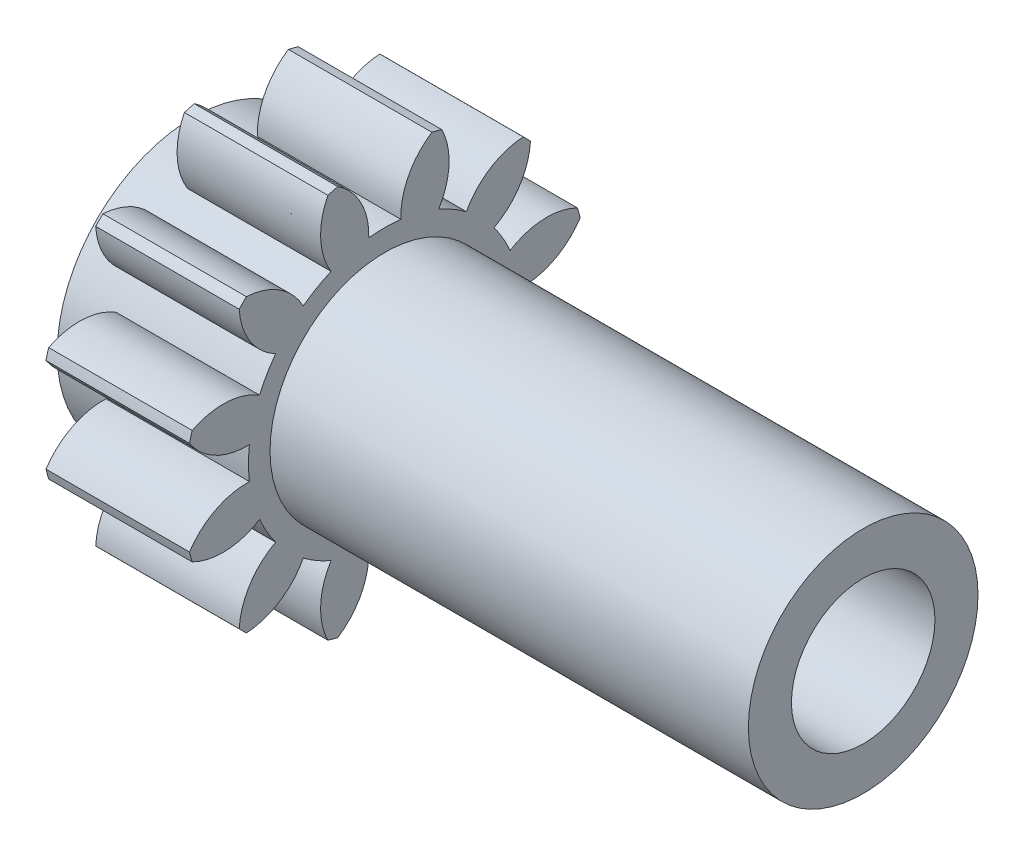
SolidWorks part; units mm, degrees
ref_plane "Plane1" through (0, 0, 0) normal (0, 0, 1) x (1, 0, 0)
ref_plane "Plane2" through (0, 0, 0) normal (0, 1, 0) x (1, 0, 0)
ref_plane "Plane3" through (0, 0, 0) normal (1, 0, 0) x (0, 0, -1)
other "Configuration Table"
sketch "HoldingSke" plane through (0, 0, 0) normal (0, 1, 0) x (1, 0, 0)
  line L0 (0, 0) -> (0.326, -0.0693)
  line L1 (-15, 0) -> (100, 0) construction
  line L2 (0, 0) -> (-2.1039, 2.3779)
  line L3 (0, 0) -> (-11.863, 4.5341)
  line L4 (0, 0) -> (8.4473, 1.7955)
  line L5 (0, 0) -> (-46.8476, -17.4728)
  line L6 (0, 0) -> (-12.4344, -8.3896)
  line L7 (-2.1039, 2.3779) -> (8.6586, 51.2059)
  line L8 (-76.2, 54.61) -> (-73.9, 54.61)
  line L9 (-71.009, 38.7566) -> (-53.1078, 45.2721)
  line L10 (-76.2, 71.12) -> (104.1128, 71.12)
  line L11 (0, 0) -> (-15, 0)
  line L12 (-76.2, 101.6) -> (-76.093, 101.6)
  line L13 (24.9733, 27.94) -> (52.9518, 28.4284)
  line L14 (24.9733, 27.94) -> (24.9743, 27.94)
  line L15 (24.9733, 27.94) -> (100.4006, 29.5858)
  line L16 (-63.627, -3) -> (-12.827, -3)
  circle A0 centre (0, 0) radius 7.5
  circle A1 centre (0, 0) radius 14.249
  circle A2 centre (0, 0) radius 37.5
  circle A3 centre (0, 0) radius 7.5
sketch "BasProSke" plane through (0, 0, 0) normal (0, 1, 0) x (1, 0, 0)
  line L0 (-10, 0) -> (60, 0) construction
  line L1 (0, 0) -> (0, 21)
  line L2 (0, 0) -> (15, 0)
  line L3 (15, 0) -> (15, 21)
  line L4 (15, 21) -> (0, 21)
revolve "Base-Revolve" add sketch "BasProSke" angle 360 about L0
sketch "TooCutSke" plane through (0, 0, 0) normal (1, 0, 0) x (0, 0, -1)
  line L1 (0, 0) -> (0, 107) construction
  line L2 (0, 0) -> (-2.5365, 17.8204) construction
  line L3 (0, 0) -> (-9.25, 34.5215) construction
  line L4 (-2.5365, 17.8204) -> (-4.625, 17.2608) construction
  arc A0 (1.6769, 14.15) -> (-1.6769, 14.15) centre (0, 0) ccw
  arc A1 (4.9456, 20.4355) -> (-4.9456, 20.4355) centre (0, 0) ccw
  circle A2 centre (0, 0) radius 18 construction
  circle A3 centre (0, 0) radius 16.9145 construction
  arc A4 (-1.6769, 14.15) -> (-4.9456, 20.4355) centre (-8.8725, 14.4006) ccw
  arc A5 (4.9456, 20.4355) -> (1.6769, 14.15) centre (8.8725, 14.4006) ccw
extrude "ToothCut" cut sketch "TooCutSke" along normal through all
fillet "Breaks" [suppressed] radius 0.06
fillet "RootFillets" [suppressed] radius 0.751
pattern_circular "TeethCuts" count 12 every 30 about axis through (-10, 0, 0) along (1, 0, 0) of "ToothCut"
sketch "HubNeaOneSke" plane through (0, 0, 0) normal (-1, 0, 0) x (0, 0, 1)
  circle A0 centre (0, 0) radius 14.249
extrude "HubNearOne" add sketch "HubNeaOneSke" along normal blind 35.0001
sketch "HubNeaBotSke" plane through (0, 0, 0) normal (-1, 0, 0) x (0, 0, 1)
  circle A0 centre (0, 0) radius 14.249
extrude "HubNearBoth" [suppressed] add sketch "HubNeaBotSke" along normal blind 17.5
ref_plane "FarPln" through (15, 0, 0) normal (1, 0, 0) x (0, 0, -1)
sketch "HubFarSke" plane through (15, 0, 0) normal (1, 0, 0) x (0, 0, -1)
  circle A0 centre (0, 0) radius 14.249
extrude "HubFar" [suppressed] add sketch "HubFarSke" along normal blind 17.5
sketch "BorSke" plane through (0, 0, 0) normal (1, 0, 0) x (0, 0, -1)
  circle A0 centre (0, 0) radius 7.5
extrude "Bore" cut sketch "BorSke" along normal mid plane 100.0001
sketch "KeySke" plane through (0, 0, 0) normal (1, 0, 0) x (0, 0, -1)
  line L0 (-2.5, 0) -> (-2.5, 9.8)
  line L1 (-2.5, 9.8) -> (2.5, 9.8)
  line L2 (2.5, 9.8) -> (2.5, 0)
  line L3 (0, 0) -> (0, 34) construction
  line L4 (-2.5, 0) -> (2.5, 0)
extrude "Keyway" [suppressed] cut sketch "KeySke" along normal mid plane 100.0001
pattern_circular "Keyway2" [suppressed] count 2 every 90 about axis through (-10, 0, 0) along (1, 0, 0)
sketch "Esquisse1" plane through (-35.0001, 0, 0) normal (-1, 0, 0) x (0, 0, 1)
  circle A0 centre (0, 0) radius 14.249
extrude "Enlèv. mat.-Extru.1" cut sketch "Esquisse1" against normal blind 30
sketch "Esquisse2" plane through (15, 0, 0) normal (1, 0, 0) x (0, 0, -1)
  circle A0 centre (0, 0) radius 12
  circle A1 centre (0, 0) radius 7.5
extrude "Boss.-Extru.1" add sketch "Esquisse2" along normal blind 50
equation "' \"Module@HoldingSke\" = 6.35"
equation "' \"Num_teeth@HoldingSke\" = 12"
equation "' \"Ap@HoldingSke\" =  20"
equation "' \"Ap@HoldingSke\" = 20"
equation "' \"Width@HoldingSke\" = 0.5 * 25.4"
equation "' \"Hub_dia@HoldingSke\"= 1 * 25.4"
equation "' \"Hub_dia@HoldingSke\" = 1 * 25.4"
equation "' \"Overall_len@HoldingSke\" = 1.0 * 25.4"
equation "' \"Bore@HoldingSke\" = 0.75 * 25.4"
equation "' \"T_dim@HoldingSke\" = 0.1 * 25.4"
equation "' \"Width@KeySke\" = 0.25 * 25.4"
equation "' \"Show_teeth@HoldingSke\" = 13"
equation "' \"Backlash@HoldingSke\" = 0.009 * 25.4"
equation "' \"Addendum_fac@HoldingSke\" = 1.0"
equation "' \"Dedendum_fac@HoldingSke\" = 1.25"
equation "' \"Dedendum_add@HoldingSke\" = 0.00005 * 25.4"
equation "' \"Clearance_fac@HoldingSke\" = 0.25"
equation "\"Pitch@HoldingSke\" = 1 / \"Module@HoldingSke\""
equation "\"Overcut_dia@TooCutSke\" = (\"Num_teeth@HoldingSke\" + 2 * \"Addendum_fac@HoldingSke\") / \"Pitch@HoldingSke\" + 0.002 * 25.4"
equation "\"Pitch_dia@TooCutSke\" = \"Num_teeth@HoldingSke\" / \"Pitch@HoldingSke\""
equation "\"Base_dia@TooCutSke\" = \"Num_teeth@HoldingSke\" / \"Pitch@HoldingSke\" * cos((\"Ap@HoldingSke\"  * 3.14159265 / 180))"
equation "\"Root_dia@TooCutSke\" = (\"Num_teeth@HoldingSke\" + 2) / \"Pitch@HoldingSke\" - 2 * (\"Addendum_fac@HoldingSke\" + \"Dedendum_fac@HoldingSke\") / \"Pitch@HoldingSke\" - \"Dedendum_add@HoldingSke\" * 2"
equation "\"Half_ang@TooCutSke\" = 180 / \"Num_teeth@HoldingSke\""
equation "\"Half_CT@TooCutSke\" = \"Num_teeth@HoldingSke\" / \"Pitch@HoldingSke\" * sin((3.14159265 / 2 / \"Num_teeth@HoldingSke\")) / 2 - 7 * \"Backlash@HoldingSke\" / 4"
equation "\"Flank_rad@TooCutSke\" = \"Num_teeth@HoldingSke\" / \"Pitch@HoldingSke\" / 5"
equation "\"Radius@RootFillets\" = \"Clearance_fac@HoldingSke\" / \"Pitch@HoldingSke\" + \"Dedendum_add@HoldingSke\""
equation "\"Break_rad@Breaks\" = 0.02 / \"Pitch@HoldingSke\""
equation "\"Thickness@HoldingSke\" = \"Width@HoldingSke\""
equation "\"OAL@HoldingSke\" = \"Thickness@HoldingSke\""
equation "\"MHD@HoldingSke\" = (\"Num_teeth@HoldingSke\" + 2) / \"Pitch@HoldingSke\" - 2 * (\"Addendum_fac@HoldingSke\" + \"Dedendum_fac@HoldingSke\")  / \"Pitch@HoldingSke\" - \"Dedendum_add@HoldingSke\" * 2"
equation "\"MBD@HoldingSke\" = (\"Num_teeth@HoldingSke\" + 2) / \"Pitch@HoldingSke\" - 2 * (\"Addendum_fac@HoldingSke\" + \"Dedendum_fac@HoldingSke\")  / \"Pitch@HoldingSke\" - \"Dedendum_add@HoldingSke\" * 2 - 0.002 * 25.4"
equation "\"MHD@HoldingSke\" = ((sgn( \"MHD@HoldingSke\" - \"Hub_dia@HoldingSke\" )-1)*( \"MHD@HoldingSke\" - \"Hub_dia@HoldingSke\" ))/-2+ \"Hub_dia@HoldingSke\""
equation "\"MBD@HoldingSke\" = ((sgn( \"MBD@HoldingSke\" - \"Bore@HoldingSke\" )-1)*( \"MBD@HoldingSke\" - \"Bore@HoldingSke\" ))/-2+ \"Bore@HoldingSke\""
equation "\"OAL@HoldingSke\" = ((sgn( \"OAL@HoldingSke\" - \"Overall_len@HoldingSke\" )+1)*( \"OAL@HoldingSke\" - \"Overall_len@HoldingSke\" ))/2 + \"Overall_len@HoldingSke\" + 0.000002 * 25.4"
equation "\"Num_teeth@TeethCuts\" = int( \"Show_teeth@HoldingSke\" ) + 1"
equation "\"Num_teeth@TeethCuts\" = ((sgn( \"Num_teeth@TeethCuts\" - \"Num_teeth@HoldingSke\" )-1)*( \"Num_teeth@TeethCuts\" - \"Num_teeth@HoldingSke\" ))/-2+ \"Num_teeth@HoldingSke\""
equation "\"Num_teeth@TeethCuts\" = ((sgn( \"Num_teeth@TeethCuts\" - 2.0)+1)*( \"Num_teeth@TeethCuts\" - 2.0))/2 +2.0"
equation "\"Angle@TeethCuts\" = 360.0 / \"Num_teeth@HoldingSke\""
equation "\"Diameter@BasProSke\" = (\"Num_teeth@HoldingSke\" + 2 * \"Addendum_fac@HoldingSke\") / \"Pitch@HoldingSke\""
equation "\"Thickness@BasProSke\"  = \"Thickness@HoldingSke\""
equation "' \"Fillet_rad@BasProSke\" =  \"Thickness@HoldingSke\" * 0.05"
equation "' \"Fillet_rad@BasProSke\" = \"Thickness@HoldingSke\" * 0.05"
equation "\"MHD@HoldingSke\" = ((sgn( \"MHD@HoldingSke\" - \"Root_dia@TooCutSke\" )-1)*( \"MHD@HoldingSke\" - \"Root_dia@TooCutSke\" ))/-2+ \"Root_dia@TooCutSke\""
equation "\"Diameter@HubNeaOneSke\" = \"MHD@HoldingSke\""
equation "\"Length@HubNearOne\" = \"OAL@HoldingSke\" - \"Thickness@BasProSke\""
equation "\"Diameter@HubNeaBotSke\" = \"MHD@HoldingSke\""
equation "\"Length@HubNearBoth\" = ( \"OAL@HoldingSke\" - \"Thickness@BasProSke\" ) / 2.0"
equation "\"Thickness@FarPln\" = \"Thickness@BasProSke\""
equation "\"Diameter@HubFarSke\" = \"MHD@HoldingSke\""
equation "\"Length@HubFar\" = ( \"OAL@HoldingSke\" - \"Thickness@BasProSke\" ) / 2.0"
equation "\"Diameter@BorSke\" = \"MBD@HoldingSke\""
equation "\"D1@Bore\" = \"OAL@HoldingSke\" * 2.0"
equation "\"D1@Keyway\" = \"OAL@HoldingSke\" * 2.0"
equation "\"Offset@KeySke\" = \"T_dim@HoldingSke\" + \"MBD@HoldingSke\" / 2.0"
